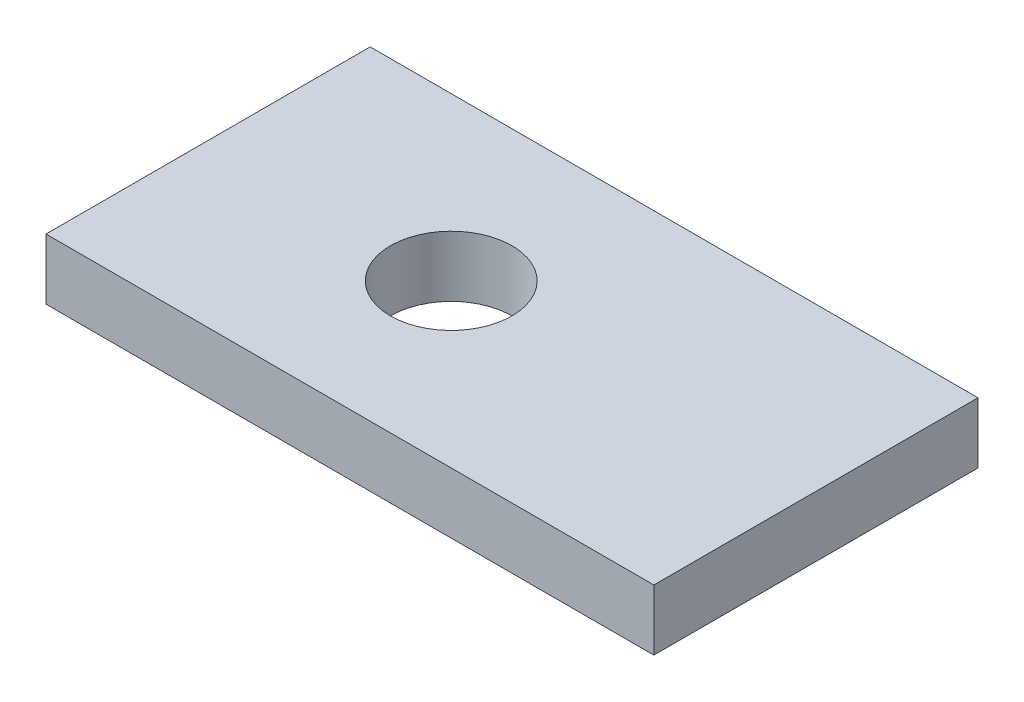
SolidWorks part; units mm, degrees
ref_plane "前视基准面" through (0, 0, 0) normal (0, 0, 1) x (1, 0, 0)
ref_plane "上视基准面" through (0, 0, 0) normal (0, 1, 0) x (1, 0, 0)
ref_plane "右视基准面" through (0, 0, 0) normal (1, 0, 0) x (0, 0, -1)
other "Configuration Table"
sketch "BaseSketch" plane through (0, 0, 0) normal (0, 1, 0) x (1, 0, 0)
  line L1 (0, 0) -> (150, 0)
  line L2 (0, 0) -> (0, 80)
  line L3 (0, 80) -> (150, 80)
  line L4 (150, 0) -> (150, 80)
  dimension "D1" = 150
  dimension "D2" = 80
extrude "BaseBoss" add sketch "BaseSketch" against normal blind 15
sketch "HoleSketch" plane through (0, 0, 0) normal (0, 1, 0) x (1, 0, 0)
  circle A0 centre (60, 40) radius 15
  dimension "D1" = 30
extrude "HoleCut" cut sketch "HoleSketch" against normal blind 15
